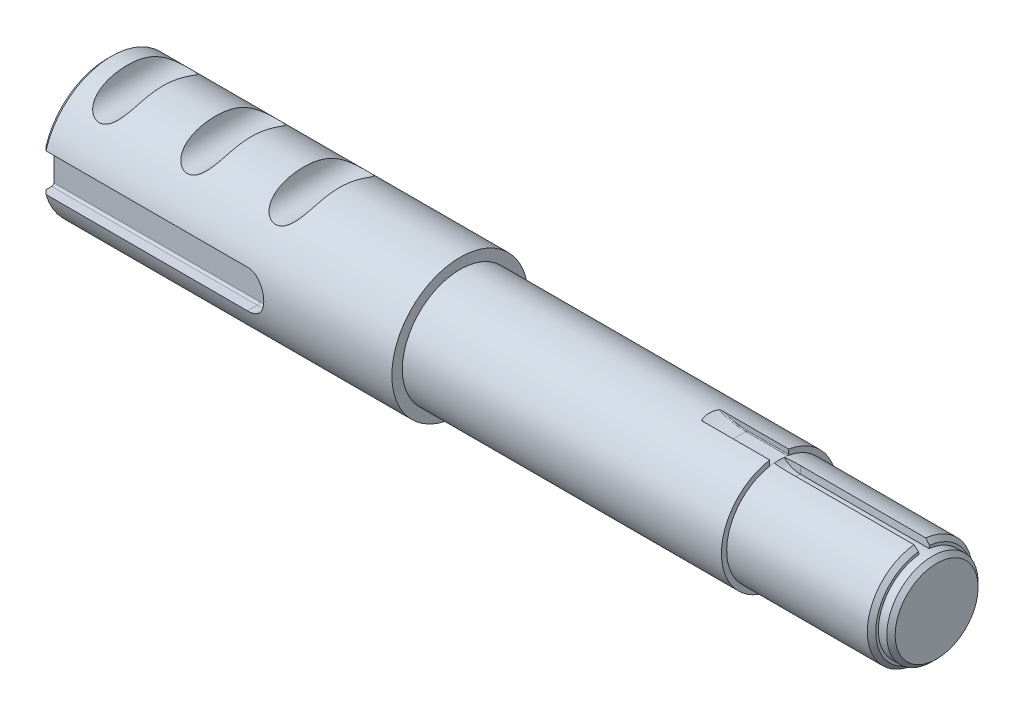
SolidWorks part; units mm, degrees
ref_plane "Plan de face" through (0, 0, 0) normal (0, 0, 1) x (1, 0, 0)
ref_plane "Plan de dessus" through (0, 0, 0) normal (0, 1, 0) x (1, 0, 0)
ref_plane "Plan de droite" through (0, 0, 0) normal (1, 0, 0) x (0, 0, -1)
sketch "Esquisse4" plane through (0, 0, 0) normal (0, 0, 1) x (1, 0, 0)
  line L0 (0, 32.5) -> (0, 0)
  line L1 (168, 27.5) -> (168, 32.5)
  line L2 (0, 0) -> (395, 0)
  line L3 (168, 32.5) -> (0, 32.5)
  line L4 (0, 0) -> (408.185, 0) construction
  line L5 (320, 27.5) -> (320, 25)
  line L6 (168, 27.5) -> (320, 27.5)
  line L11 (320, 25) -> (389, 25)
  line L12 (389, 25) -> (389, 21.75)
  line L13 (389, 21.75) -> (395, 21.75)
  line L14 (395, 21.75) -> (395, 0)
  point P12 (277, 0)
  dimension "D5" = 75
  dimension "D7" = 32.5
  dimension "D2" = 27.5
  dimension "D3" = 168
  dimension "D4" = 25
  dimension "D10" = 395
  dimension "D12" = 6
  dimension "D13" = 21.75
revolve "Révolution1" add sketch "Esquisse4" angle 360 about L4
chamfer "Chanfrein1" distance 2 angle 45 2 edges at (395, 0, 21.75) (389, 0, 25)
chamfer "Chanfrein2" distance 2 angle 45 1 edges at (0, 0, 32.5)
sketch "Esquisse5" plane through (0, 0, 0) normal (0, 0, 1) x (1, 0, 0)
  line L0 (168, 32.5) -> (2, 32.5) construction
  line L1 (0, 30.5) -> (0, -30.5) construction
  line L2 (2, -32.5) -> (168, -32.5) construction
  circle A0 centre (18, 32.5) radius 8.5
  circle A1 centre (60, 32.5) radius 8.5
  circle A2 centre (18, -32.5) radius 8.5
  circle A3 centre (60, -32.5) radius 8.5
  circle A4 centre (102, 32.5) radius 8.5
  circle A5 centre (102, -32.5) radius 8.5
  dimension "D1" = 17
  dimension "D2" = 17
  dimension "D5" = 17
  dimension "D6" = 17
  dimension "D9" = 17
  dimension "D10" = 17
  dimension "D3" = 18
  dimension "D4" = 60
  dimension "D7" = 18
  dimension "D8" = 60
  dimension "D11" = 102
  dimension "D12" = 102
extrude "Extrusion3" cut sketch "Esquisse5" against normal mid plane 152
ref_plane "Plan1" through (0, 0, 32.5) normal (0, 0, 1) x (1, 0, 0)
sketch "Esquisse6" plane through (0, 0, 32.5) normal (0, 0, 1) x (1, 0, 0)
  line L0 (0, 30.5) -> (0, -30.5) construction
  line L1 (0, 9) -> (98, 9)
  line L2 (0, 9) -> (0, -9)
  line L3 (0, -9) -> (98, -9)
  line L5 (0, 0) -> (97.6711, 0) construction
  arc A0 (98, 9) -> (98, -9) centre (98, 0) cw
  dimension "D2" = 9
  dimension "D1" = 18
  dimension "D3" = 98
extrude "Extrusion4" cut sketch "Esquisse6" against normal blind 7
sketch "Esquisse7" plane through (0, 0, 0) normal (0, 0, 1) x (1, 0, 0)
  line L0 (320, 24.5) -> (300, 24.5)
  line L2 (395, -19.75) -> (395, 19.75) construction
  line L3 (320, 27.5) -> (168, 27.5) construction
  line L4 (270.562, 44.7904) -> (320, 44.7904)
  line L5 (320, 44.7904) -> (320, 24.5)
  arc A0 (300, 24.5) -> (270.562, 44.7904) centre (300, 56) cw
  dimension "D2" = 31.5
  dimension "D1" = 95
  dimension "D3" = 3
extrude "Extrusion5" cut sketch "Esquisse7" against normal mid plane 9
fillet "Congé2" radius 1 3 edges at (49, -9, 25.5) (107, 0, 25.5) (49, 9, 25.5)
fillet "Congé3" radius 0.4 4 edges at (293.5648, 25.1643, 4.5) (293.5648, 25.1643, -4.5) (310, 24.5, 4.5) (310, 24.5, -4.5)
sketch "Esquisse8" plane through (389, 0, 0) normal (1, 0, 0) x (0, 0, -1)
  line L1 (-2.435, 21.6133) -> (-2.9135, 25.8132)
  line L2 (-2.9135, 25.8132) -> (2.9135, 25.8132)
  line L4 (2.435, 21.6133) -> (2.9135, 25.8132)
  circle A0 centre (0, 0) radius 21.75 construction
  arc A1 (2.435, 21.6133) -> (-2.435, 21.6133) centre (0, 0) ccw
sketch "Esquisse9" plane through (0, 0, 0) normal (0, 0, 1) x (1, 0, 0)
  line L0 (389, 21.75) -> (327.6111, 21.75)
  line L3 (393, 21.75) -> (389, 21.75) construction
  line L4 (395, -19.75) -> (395, 19.75) construction
  line L5 (389, 21.6133) -> (389, 21.75) construction
  line L6 (300, 24.9) -> (320, 24.9) construction
  arc A0 (327.6111, 21.75) -> (320, 24.9) centre (327.6111, 32.5201) cw
  dimension "D1" = 75
sweep "Enlèvement de matière-Balayage19" cut profiles "Esquisse8" path "Esquisse9"
pattern_circular "Répétition circulaire1" [suppressed] count 16 over 360
